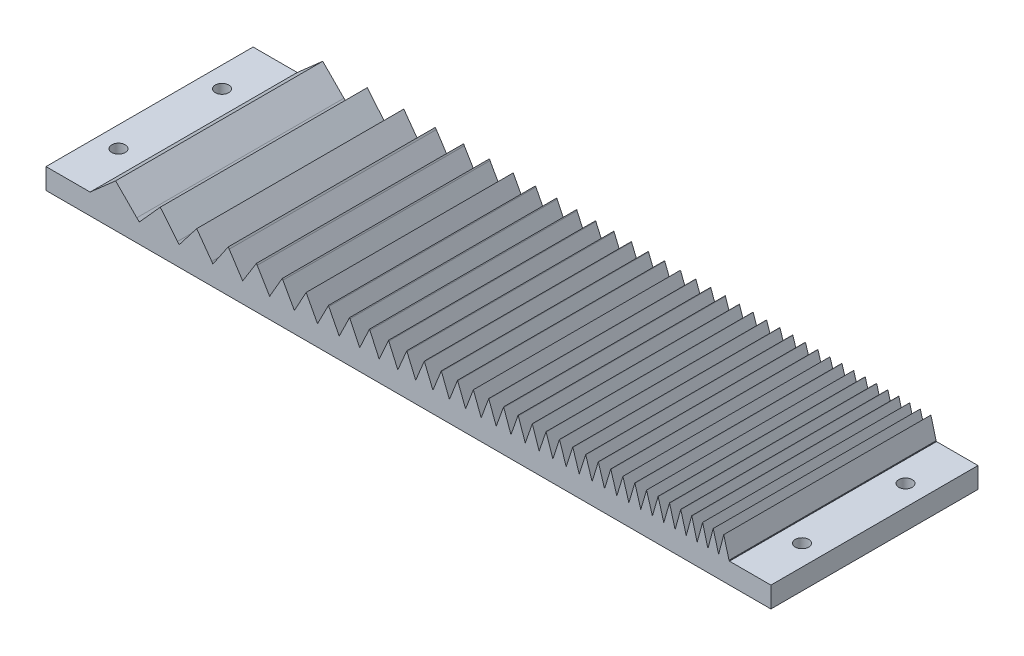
SolidWorks part; units mm, degrees
ref_plane "Front Plane" through (0, 0, 0) normal (0, 0, 1) x (1, 0, 0)
ref_plane "Top Plane" through (0, 0, 0) normal (0, 1, 0) x (1, 0, 0)
ref_plane "Right Plane" through (0, 0, 0) normal (1, 0, 0) x (0, 0, -1)
sketch "Model" plane through (0, 0, 0) normal (0, 0, 1) x (1, 0, 0)
  line L0 (0, 0) -> (-20, 0)
  line L1 (-20, 0) -> (-20, -10)
  line L2 (-20, -10) -> (330, -10)
  line L3 (0, 0) -> (1.3066, 0)
  line L4 (330, -10) -> (330, 0)
  line L5 (330, 0) -> (310, 0)
  line L6 (310, 0) -> (310, 0.2535)
  line L7 (310, 0.2535) -> (309.7638, 0.2535)
  line L8 (283.7082, 0.2709) -> (283.7537, 0.1055)
  line L9 (283.7537, 0.1055) -> (283.8084, 0.2376)
  line L21 (2.1073, 0.7053) -> (11.9283, 9.3555)
  line L22 (11.9283, 9.3555) -> (13.616, 10.8421)
  line L23 (15.0349, 9.4104) -> (13.616, 10.8421)
  line L24 (34.1757, 9.5101) -> (35.1447, 10.591)
  line L25 (35.9796, 9.5765) -> (35.1447, 10.591)
  line L26 (2.1073, 0.7053) -> (1.3066, 0)
  line L27 (52.114, 9.6021) -> (52.7484, 10.4246)
  line L28 (53.3166, 9.6408) -> (52.7484, 10.4246)
  line L29 (61.1332, 0.3432) -> (60.5737, -0.4779)
  line L30 (26.0584, 0.4555) -> (25.0628, -0.655)
  line L31 (25.0628, -0.655) -> (23.8537, 0.5124)
  line L32 (44.9988, 0.3767) -> (44.3099, -0.5166)
  line L33 (44.3099, -0.5166) -> (43.4956, 0.4433)
  line L34 (60.5737, -0.4779) -> (60.0309, 0.3781)
  line L35 (67.4467, 9.6071) -> (68.0039, 10.4246)
  line L36 (68.0039, 10.4246) -> (68.4489, 9.662)
  line L37 (74.5619, 0.3334) -> (74.9883, -0.3173)
  line L38 (74.9883, -0.3173) -> (75.3636, 0.305)
  line L39 (87.5897, 0.341) -> (87.9973, -0.338)
  line L40 (87.9973, -0.338) -> (88.2912, 0.2877)
  line L41 (99.6154, 0.3256) -> (99.9451, -0.2669)
  line L42 (99.9451, -0.2669) -> (100.2166, 0.281)
  line L43 (110.8393, 0.2965) -> (111.0999, -0.1937)
  line L44 (111.0999, -0.1937) -> (111.3404, 0.2806)
  line L45 (121.3618, 0.2793) -> (121.5378, -0.0518)
  line L46 (121.5378, -0.0518) -> (121.7626, 0.2692)
  line L47 (131.2829, 0.2758) -> (131.4394, -0.0518)
  line L48 (131.4394, -0.0518) -> (131.5836, 0.249)
  line L49 (140.703, 0.2791) -> (140.8695, -0.0858)
  line L50 (140.8695, -0.0858) -> (141.0037, 0.2504)
  line L51 (149.7223, 0.2748) -> (149.8826, -0.0858)
  line L52 (149.8826, -0.0858) -> (150.023, 0.2566)
  line L53 (15.0349, 9.4104) -> (23.8537, 0.5124)
  line L54 (158.3407, 0.2855) -> (158.4981, -0.0858)
  line L55 (158.4981, -0.0858) -> (158.6414, 0.2533)
  line L56 (166.6584, 0.2845) -> (166.8113, -0.0858)
  line L57 (166.8113, -0.0858) -> (166.9591, 0.2574)
  line L58 (174.6755, 0.2881) -> (174.7886, 0)
  line L59 (174.7886, 0) -> (174.876, 0.2381)
  line L60 (182.4922, 0.2614) -> (182.5944, 0)
  line L61 (182.5944, 0) -> (182.6926, 0.2477)
  line L62 (190.0083, 0.2632) -> (190.1084, 0)
  line L63 (190.1084, 0) -> (190.2087, 0.2481)
  line L64 (197.3239, 0.258) -> (197.3752, 0.1191)
  line L65 (197.3752, 0.1191) -> (197.4241, 0.2377)
  line L66 (204.4391, 0.2533) -> (204.4997, 0.0892)
  line L67 (204.4997, 0.0892) -> (204.5393, 0.2378)
  line L68 (211.3538, 0.2543) -> (211.3854, 0.1635)
  line L69 (211.3854, 0.1635) -> (211.454, 0.2378)
  line L70 (218.0681, 0.2688) -> (218.1255, 0.0993)
  line L71 (218.1255, 0.0993) -> (218.1683, 0.2386)
  line L72 (224.6823, 0.2571) -> (224.739, 0.0892)
  line L73 (224.739, 0.0892) -> (224.7825, 0.2378)
  line L74 (231.096, 0.2701) -> (231.143, 0.1312)
  line L75 (231.143, 0.1312) -> (231.1962, 0.2384)
  line L76 (26.0584, 0.4555) -> (34.1757, 9.5101)
  line L77 (237.4094, 0.2644) -> (237.4545, 0.1312)
  line L78 (237.4545, 0.1312) -> (237.5096, 0.2377)
  line L79 (243.6227, 0.2474) -> (243.6623, 0.1222)
  line L80 (243.6623, 0.1222) -> (243.7229, 0.2412)
  line L81 (249.6355, 0.2627) -> (249.6786, 0.1222)
  line L82 (249.6786, 0.1222) -> (249.7357, 0.2377)
  line L83 (255.5481, 0.2758) -> (255.6034, 0.0892)
  line L84 (255.6034, 0.0892) -> (255.6483, 0.2386)
  line L85 (261.3605, 0.2856) -> (261.4188, 0.0892)
  line L86 (261.4188, 0.0892) -> (261.4607, 0.2402)
  line L87 (294.3776, 0.1222) -> (294.4311, 0.2384)
  line L88 (299.542, 0.276) -> (299.6044, 0.0402)
  line L89 (299.6044, 0.0402) -> (299.6422, 0.2377)
  line L90 (81.176, 9.6269) -> (81.6389, 10.3693)
  line L91 (81.6389, 10.3693) -> (81.9777, 9.6897)
  line L92 (93.7028, 9.6466) -> (94.1163, 10.3097)
  line L93 (94.1163, 10.3097) -> (94.4042, 9.6897)
  line L94 (105.3275, 9.6803) -> (105.5918, 10.1663)
  line L95 (35.9796, 9.5765) -> (43.4956, 0.4433)
  line L96 (105.8286, 9.7208) -> (105.5918, 10.1663)
  line L97 (116.1507, 9.6883) -> (116.3951, 10.1663)
  line L98 (116.3951, 10.1663) -> (116.5515, 9.7353)
  line L99 (126.3725, 9.7042) -> (126.6088, 10.1663)
  line L100 (126.6088, 10.1663) -> (126.7733, 9.7186)
  line L101 (135.993, 9.6842) -> (136.2395, 10.1663)
  line L102 (136.2395, 10.1663) -> (136.3939, 9.7261)
  line L103 (145.2127, 9.6873) -> (145.3858, 10.0754)
  line L104 (145.3858, 10.0754) -> (145.5133, 9.7449)
  line L105 (154.0315, 9.6858) -> (154.2148, 10.1171)
  line L106 (154.2148, 10.1171) -> (154.3322, 9.7432)
  line L107 (162.5497, 9.7086) -> (162.67, 9.9997)
  line L108 (162.67, 9.9997) -> (162.7501, 9.7493)
  line L109 (170.7672, 9.7302) -> (170.8755, 9.9997)
  line L110 (170.8755, 9.9997) -> (170.9676, 9.7399)
  line L111 (44.9988, 0.3767) -> (52.114, 9.6021)
  line L112 (178.5839, 9.6978) -> (178.7053, 9.9997)
  line L113 (178.7053, 9.9997) -> (178.7843, 9.7497)
  line L114 (186.3004, 9.7335) -> (186.3551, 9.8697)
  line L115 (186.4006, 9.7502) -> (186.3551, 9.8697)
  line L116 (193.7162, 9.7359) -> (193.7773, 9.9012)
  line L117 (193.7773, 9.9012) -> (193.8164, 9.75)
  line L118 (200.8313, 9.695) -> (200.944, 9.9997)
  line L119 (200.944, 9.9997) -> (201.0318, 9.7487)
  line L120 (207.8463, 9.6982) -> (207.9578, 9.9997)
  line L121 (207.9578, 9.9997) -> (208.0468, 9.7474)
  line L122 (214.7611, 9.738) -> (214.8214, 9.9012)
  line L123 (214.8214, 9.9012) -> (214.8613, 9.749)
  line L124 (53.3166, 9.6408) -> (60.0309, 0.3781)
  line L125 (221.3752, 9.7154) -> (221.4287, 9.8736)
  line L126 (221.4287, 9.8736) -> (221.4754, 9.7486)
  line L127 (227.8891, 9.7154) -> (227.941, 9.8736)
  line L128 (227.941, 9.8736) -> (227.9893, 9.7489)
  line L129 (234.3028, 9.7356) -> (234.357, 9.9012)
  line L130 (234.357, 9.9012) -> (234.403, 9.749)
  line L131 (240.516, 9.7257) -> (240.5716, 9.9012)
  line L132 (240.5716, 9.9012) -> (240.6163, 9.7502)
  line L133 (246.6291, 9.727) -> (246.69, 9.9257)
  line L134 (246.69, 9.9257) -> (246.7293, 9.7501)
  line L135 (252.6419, 9.7363) -> (252.6924, 9.9012)
  line L136 (61.1332, 0.3432) -> (67.4467, 9.6071)
  line L137 (252.6924, 9.9012) -> (252.7421, 9.748)
  line L138 (275.4907, 9.7042) -> (275.5509, 9.9012)
  line L139 (275.5509, 9.9012) -> (275.5909, 9.7486)
  line L140 (264.2667, 9.7228) -> (264.3195, 9.9012)
  line L141 (264.3195, 9.9012) -> (264.3669, 9.7501)
  line L142 (281.0024, 9.7204) -> (281.0611, 9.9257)
  line L143 (281.0611, 9.9257) -> (281.1026, 9.7501)
  line L144 (286.414, 9.7264) -> (286.4709, 9.9257)
  line L145 (286.4709, 9.9257) -> (286.5142, 9.7494)
  line L146 (291.7253, 9.722) -> (291.7813, 9.9257)
  line L147 (68.4489, 9.662) -> (74.5619, 0.3334)
  line L148 (291.7813, 9.9257) -> (291.8255, 9.7499)
  line L156 (75.3636, 0.305) -> (81.176, 9.6269)
  line L165 (81.9777, 9.6897) -> (87.5897, 0.341)
  line L173 (88.2912, 0.2877) -> (93.7028, 9.6466)
  line L181 (94.4042, 9.6897) -> (99.6154, 0.3256)
  line L188 (100.2166, 0.281) -> (105.3275, 9.6803)
  line L194 (105.8286, 9.7208) -> (110.8393, 0.2965)
  line L200 (111.3404, 0.2806) -> (116.1507, 9.6883)
  line L205 (116.5515, 9.7353) -> (121.3618, 0.2793)
  line L210 (121.7626, 0.2692) -> (126.3725, 9.7042)
  line L215 (126.7733, 9.7186) -> (131.2829, 0.2758)
  line L219 (131.5836, 0.249) -> (135.993, 9.6842)
  line L224 (136.3939, 9.7261) -> (140.703, 0.2791)
  line L228 (141.0037, 0.2504) -> (145.2127, 9.6873)
  line L232 (145.5133, 9.7449) -> (149.7223, 0.2748)
  line L236 (150.023, 0.2566) -> (154.0315, 9.6858)
  line L240 (154.3322, 9.7432) -> (158.3407, 0.2855)
  line L244 (158.6414, 0.2533) -> (162.5497, 9.7086)
  line L247 (162.7501, 9.7493) -> (166.6584, 0.2845)
  line L251 (166.9591, 0.2574) -> (170.7672, 9.7302)
  line L254 (170.9676, 9.7399) -> (174.6755, 0.2881)
  line L257 (174.876, 0.2381) -> (178.5839, 9.6978)
  line L260 (178.7843, 9.7497) -> (182.4922, 0.2614)
  line L263 (182.6926, 0.2477) -> (186.3004, 9.7335)
  line L265 (186.4006, 9.7502) -> (190.0083, 0.2632)
  line L268 (190.2087, 0.2481) -> (193.7162, 9.7359)
  line L270 (193.8164, 9.75) -> (197.3239, 0.258)
  line L272 (197.4241, 0.2377) -> (200.8313, 9.695)
  line L275 (201.0318, 9.7487) -> (204.4391, 0.2533)
  line L277 (204.5393, 0.2378) -> (207.8463, 9.6982)
  line L280 (208.0468, 9.7474) -> (211.3538, 0.2543)
  line L282 (211.454, 0.2378) -> (214.7611, 9.738)
  line L284 (214.8613, 9.749) -> (218.0681, 0.2688)
  line L286 (218.1683, 0.2386) -> (221.3752, 9.7154)
  line L288 (221.4754, 9.7486) -> (224.6823, 0.2571)
  line L290 (224.7825, 0.2378) -> (227.8891, 9.7154)
  line L292 (227.9893, 9.7489) -> (231.096, 0.2701)
  line L294 (231.1962, 0.2384) -> (234.3028, 9.7356)
  line L296 (234.403, 9.749) -> (237.4094, 0.2644)
  line L298 (237.5096, 0.2377) -> (240.516, 9.7257)
  line L300 (240.6163, 9.7502) -> (243.6227, 0.2474)
  line L302 (243.7229, 0.2412) -> (246.6291, 9.727)
  line L304 (246.7293, 9.7501) -> (249.6355, 0.2627)
  line L306 (249.7357, 0.2377) -> (252.6419, 9.7363)
  line L308 (252.7421, 9.748) -> (255.5481, 0.2758)
  line L310 (255.6483, 0.2386) -> (258.5545, 9.7462)
  line L311 (258.5545, 9.7462) -> (261.3605, 0.2856)
  line L313 (261.4607, 0.2402) -> (264.2667, 9.7228)
  line L315 (264.3669, 9.7501) -> (267.1729, 0.2423)
  line L316 (267.1729, 0.2423) -> (269.9789, 9.7403)
  line L317 (269.9789, 9.7403) -> (272.7849, 0.2457)
  line L318 (272.7849, 0.2457) -> (275.4907, 9.7042)
  line L320 (275.5909, 9.7486) -> (278.2967, 0.2532)
  line L321 (278.2967, 0.2532) -> (281.0024, 9.7204)
  line L323 (281.1026, 9.7501) -> (283.7082, 0.2709)
  line L325 (283.8084, 0.2376) -> (286.414, 9.7264)
  line L327 (286.5142, 9.7494) -> (289.1198, 0.2454)
  line L328 (289.1198, 0.2454) -> (291.7253, 9.722)
  line L330 (291.8255, 9.7499) -> (294.3309, 0.2826)
  line L332 (294.4311, 0.2384) -> (297.0367, 9.7489)
  line L333 (297.0367, 9.7489) -> (299.542, 0.276)
  line L335 (299.6422, 0.2377) -> (302.1476, 9.732)
  line L336 (302.1476, 9.732) -> (304.7531, 0.2391)
  line L337 (304.7531, 0.2391) -> (307.2585, 9.7403)
  line L338 (307.2585, 9.7403) -> (309.7638, 0.2535)
  arc A0 (294.3309, 0.2826) -> (294.3776, 0.1222) centre (297.6304, 1.1558) ccw
extrude "Boss-Extrude1" add sketch "Model" along normal blind 100
sketch "Sketch2" plane through (0, -10, 0) normal (0, -1, 0) x (1, 0, 0)
  line L0 (-20, 50) -> (330, 50) construction
  line L1 (-20, 100) -> (-20, 0) construction
  line L2 (330, 100) -> (330, 0) construction
  line L4 (-20, 100) -> (330, 100) construction
  line L5 (155, 100) -> (155, 0) construction
  line L6 (-20, 0) -> (330, 0) construction
  circle A0 centre (-10, 75) radius 3.25
  circle A1 centre (-10, 25) radius 3.25
  circle A2 centre (320, 25) radius 3.25
  circle A3 centre (320, 75) radius 3.25
  dimension "D1" = 6.5
  dimension "D2" = 25
  dimension "D3" = 10
extrude "Cut-Extrude1" cut sketch "Sketch2" against normal through all
